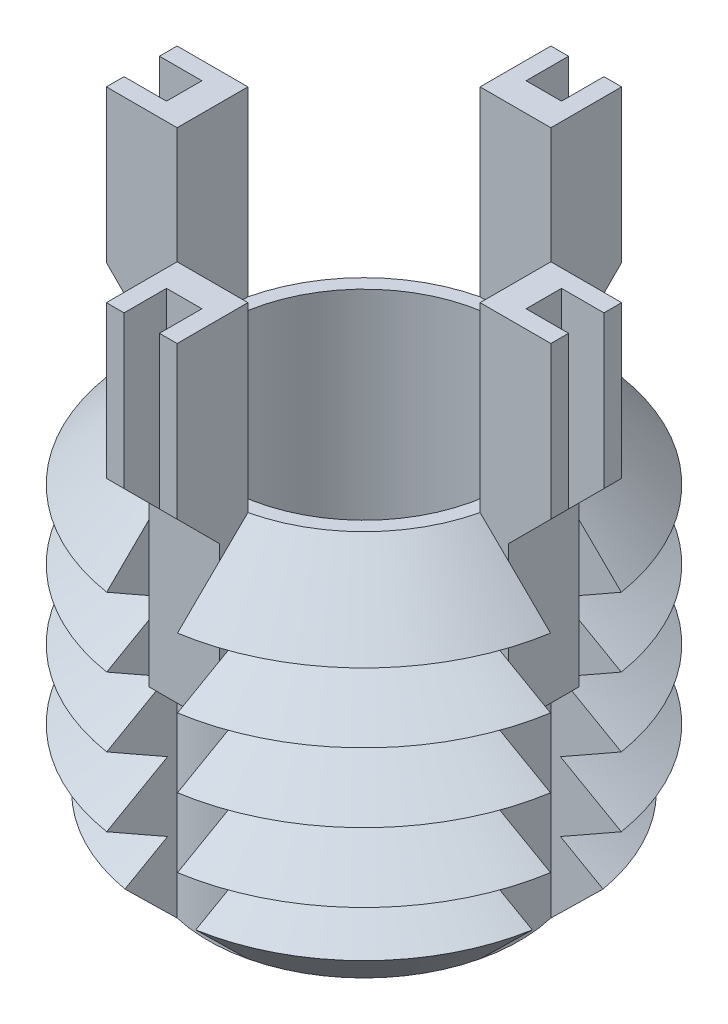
SolidWorks part; units mm, degrees
ref_plane "Front Plane" through (0, 0, 0) normal (0, 0, 1) x (1, 0, 0)
ref_plane "Top Plane" through (0, 0, 0) normal (0, 1, 0) x (1, 0, 0)
ref_plane "Right Plane" through (0, 0, 0) normal (1, 0, 0) x (0, 0, -1)
sketch "Sketch1" plane through (0, 0, 0) normal (0, 1, 0) x (1, 0, 0)
  circle A0 centre (0, 0) radius 6.35
  dimension "D1" = 12.7
extrude "Boss-Extrude1" add sketch "Sketch1" against normal blind 10.922
chamfer "Chamfer1" distance 1.954 angle 45 2 edges at (0, -10.922, 6.35) (0, 0, 6.35)
sketch "Sketch2" plane through (0, 0, 0) normal (1, 0, 0) x (0, 0, -1)
  line L0 (0, 0.8859) -> (0, -9.2617) construction
sketch "Sketch3" plane through (0, 0, 0) normal (1, 0, 0) x (0, 0, -1)
  line L0 (-6.35, -1.954) -> (-4.6578, -2.931)
  line L1 (-4.6578, -2.931) -> (-6.35, -3.908)
  line L2 (-6.35, -1.954) -> (-6.35, -8.968) construction
  line L3 (-6.35, -3.908) -> (-6.35, -1.954)
  dimension "D1" = 1.954
revolve "Cut-Revolve1" cut sketch "Sketch3" angle 360 about L0
pattern_linear "LPattern1" count 4 spacing 1.954 along (0, -1, 0) of "Cut-Revolve1"
sketch "Sketch4" plane through (0, 0, 0) normal (0, 1, 0) x (1, 0, 0)
  line L0 (-4.2807, 1) -> (-6.2708, 1)
  line L2 (-6.2708, -1) -> (-4.2807, -1)
  arc A0 (-4.2807, 1) -> (-4.2807, -1) centre (0, 0) ccw
  arc A1 (-6.2708, 1) -> (-6.2708, -1) centre (0, 0) ccw
  circle A2 centre (0, 0) radius 6.35 construction
  circle A3 centre (0, 0) radius 4.396 construction
  point P1 (-4.396, 0)
  point P3 (-6.35, 0)
  point P13 (0, 0)
  dimension "D1" = 2
extrude "Cut-Extrude1" cut sketch "Sketch4" against normal up to surface (10.922 mm away)
pattern_circular "CirPattern1" count 4 over 360 about axis through (0, 0, 0) along (0, 1, 0) of "Cut-Extrude1"
sketch "Sketch5" plane through (0, 0, 0) normal (1, 0, 0) x (0, 0, -1)
  line L0 (-4.2807, 5.138) -> (-4.2807, -4.862)
  line L1 (-4.2807, -4.862) -> (-5.0807, -4.862)
  line L2 (-5.0807, -4.862) -> (-5.0807, -0.362)
  line L3 (-5.0807, -0.362) -> (-6.2807, 0.838)
  line L4 (-6.2807, 0.838) -> (-6.2807, 5.138)
  line L5 (-6.2807, 5.138) -> (-4.2807, 5.138)
  line L6 (-6.2708, -5.862) -> (-1, -5.862) construction
  point P9 (-1, 0)
  point P10 (-5.0807, -0.362)
  dimension "D1" = 1
  dimension "D2" = 10
  dimension "D3" = 5.5
  dimension "D4" = 2
  dimension "D5" = 0.8
  dimension "D6" = 45
extrude "Boss-Extrude3" add sketch "Sketch5" along normal mid plane 2
pattern_circular "CirPattern2" count 4 over 360 about axis through (0, 0, 0) along (0, 1, 0) of "Boss-Extrude3"
sketch "Sketch6" plane through (0, 5.138, 0) normal (0, 1, 0) x (1, 0, 0)
  line L0 (-6.2807, -1) -> (-6.2807, 1) construction
  line L1 (-6.2807, -0.5) -> (-5.0807, -0.5)
  line L2 (-6.2807, -0.5) -> (-6.2807, 0.5)
  line L3 (-6.2807, 0.5) -> (-5.0807, 0.5)
  line L4 (-5.0807, -0.5) -> (-5.0807, 0.5)
  line L5 (-6.2807, -0.5) -> (-5.0807, 0.5) construction
  line L6 (-6.2807, 0.5) -> (-5.0807, -0.5) construction
  line L7 (6.2807, 1) -> (6.2807, -1) construction
  line L8 (-0.5, 5.0807) -> (0.5, 5.0807)
  line L9 (-0.5, 5.0807) -> (-0.5, 6.2807)
  line L10 (-0.5, 6.2807) -> (0.5, 6.2807)
  line L11 (0.5, 5.0807) -> (0.5, 6.2807)
  line L12 (-0.5, 5.0807) -> (0.5, 6.2807) construction
  line L13 (-0.5, 6.2807) -> (0.5, 5.0807) construction
  line L14 (5.0807, -0.5) -> (6.2807, -0.5)
  line L15 (5.0807, -0.5) -> (5.0807, 0.5)
  line L16 (5.0807, 0.5) -> (6.2807, 0.5)
  line L17 (6.2807, -0.5) -> (6.2807, 0.5)
  line L18 (5.0807, -0.5) -> (6.2807, 0.5) construction
  line L19 (5.0807, 0.5) -> (6.2807, -0.5) construction
  line L20 (-0.5, -6.2807) -> (0.5, -6.2807)
  line L21 (-0.5, -6.2807) -> (-0.5, -5.0807)
  line L22 (-0.5, -5.0807) -> (0.5, -5.0807)
  line L23 (0.5, -6.2807) -> (0.5, -5.0807)
  line L24 (-0.5, -6.2807) -> (0.5, -5.0807) construction
  line L25 (-0.5, -5.0807) -> (0.5, -6.2807) construction
  line L26 (-1, 6.2807) -> (1, 6.2807) construction
  line L27 (1, -6.2807) -> (-1, -6.2807) construction
  point P0 (-5.6807, 0)
  point P7 (-6.2807, 0)
  point P8 (-6.2807, 0)
  point P9 (0, 5.6807)
  point P14 (5.6807, 0)
  point P19 (0, -5.6807)
  point P24 (0, 6.2807)
  point P25 (6.2807, 0)
  point P26 (6.2807, 0)
  point P27 (0, 6.2807)
  point P30 (0, -6.2807)
  point P33 (0, -6.2807)
  dimension "D1" = 1
  dimension "D2" = 1.2
extrude "Cut-Extrude3" cut sketch "Sketch6" against normal up to surface (4.3 mm away)
sketch "Sketch7" plane through (0, 0, 0) normal (0, 1, 0) x (1, 0, 0)
  circle A0 centre (0, 0) radius 4
  dimension "D1" = 8
extrude "Cut-Extrude4" cut sketch "Sketch7" against normal up to surface (10.922 mm away)
